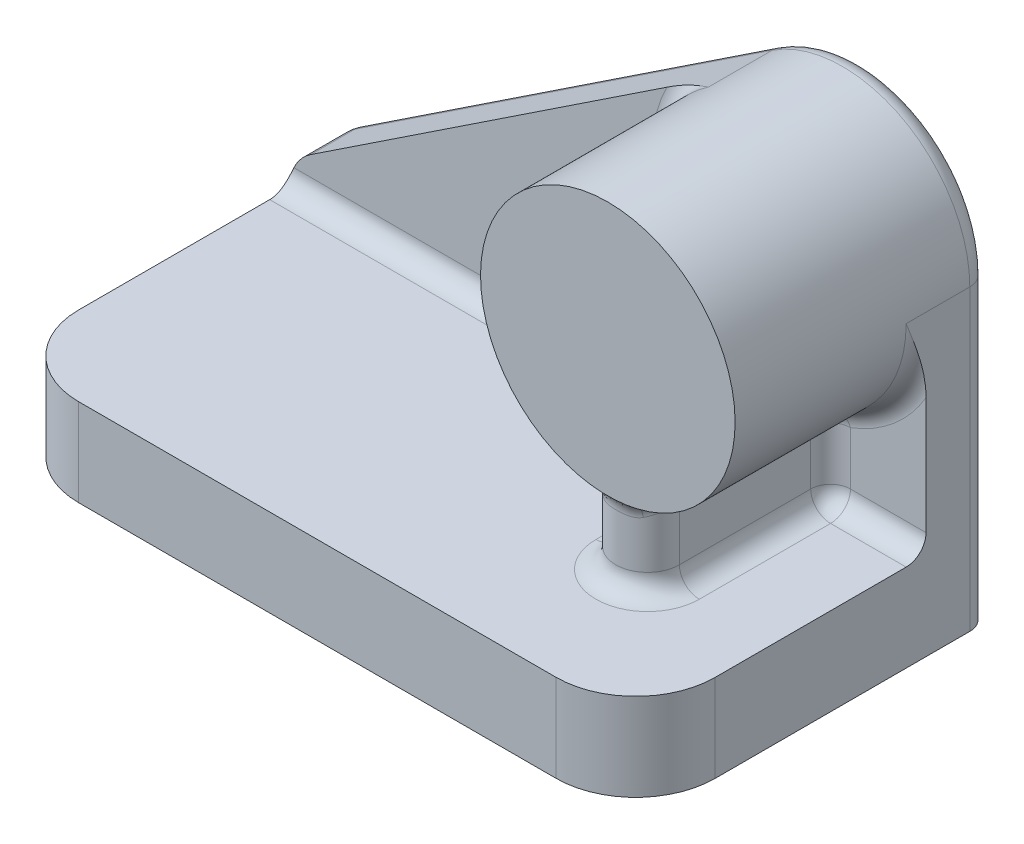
SolidWorks part; units mm, degrees
ref_plane "Front" through (0, 0, 0) normal (0, 0, 1) x (1, 0, 0)
ref_plane "Top" through (0, 0, 0) normal (0, 1, 0) x (1, 0, 0)
ref_plane "Right" through (0, 0, 0) normal (1, 0, 0) x (0, 0, -1)
sketch "Sketch1" plane through (0, 0, 0) normal (0, 1, 0) x (1, 0, 0)
  line L0 (0, 0) -> (160, 0)
  line L1 (0, 0) -> (0, 89)
  line L2 (0, 89) -> (160, 89)
  line L3 (160, 89) -> (160, 0)
  dimension "D1" = 89
  dimension "D4" = 160
extrude "Base_Plate" add sketch "Sketch1" along normal blind 22
fillet "Base_Fillet" radius 20 2 edges at (0, 11, 0) (160, 11, 0)
shell "Wall_Thickness" thickness 2
sketch "Sketch2" plane through (0, 0, -89) normal (0, 0, -1) x (-1, 0, 0)
  line L1 (-20, 0) -> (-140, 0) construction
  line L2 (-160, 22) -> (0, 22) construction
  line L3 (-160, 22) -> (0, 22)
  line L4 (-160, 22) -> (-160, 0) construction
  line L5 (-160, 22) -> (-160, 75)
  line L6 (-5.3632, 31.9976) -> (-110.3018, 101.6603)
  arc A0 (-110.3018, 101.6603) -> (-160, 75) centre (-128, 75) ccw
  arc A1 (0, 22) -> (-5.3632, 31.9976) centre (-12, 22) ccw
  dimension "D1" = 64
  dimension "D4" = 12
  dimension "D2" = 75
extrude "Vertical_Plate" add sketch "Sketch2" against normal blind 16
sketch "Sketch3" plane through (0, 0, -89) normal (0, 0, -1) x (-1, 0, 0)
  circle A0 centre (-128, 75) radius 32
  arc A1 (-110.3018, 101.6603) -> (-160, 75) centre (-128, 75) ccw construction
extrude "Circular_Boss" add sketch "Sketch3" against normal blind 64
sketch "Sketch4" plane through (0, 22, 0) normal (0, 1, 0) x (-1, 0, 0)
  line L0 (-96, -25) -> (-160, -25) construction
  line L1 (-96, -73) -> (-160, -73) construction
  line L2 (-120, -73) -> (-120, -35)
  line L3 (-128, -73) -> (-128, -89) construction
  line L5 (-136, -73) -> (-136, -35)
  line L7 (-136, -73) -> (-120, -73)
  arc A0 (-120, -35) -> (-136, -35) centre (-128, -35) ccw
  dimension "D2" = 8
  dimension "D1" = 2
extrude "Rib_Under" add sketch "Sketch4" along normal up to next
fillet "Rib_Fillet" radius 5 7 edges at (120, 44.0161, -54) (120, 22, -54) (127.1921, 43.0102, -27.0409) (128, 22, -27) (136, 22, -54) (136, 44.0161, -54)
fillet "Circ_Fillet" radius 5 18 edges at (1.4255, 27.6726, -89) (57.8325, 66.829, -89) (143.1271, 103.1988, -89) (154.3038, 56.7762, -73) (160, 37.5, -89) (0, 11, -89) (96.206, 71.3753, -73) (136, 33.6795, -73) (137.4645, 23.4645, -73) (136.89, 43.2065, -73) (120, 33.6795, -73) (118.5355, 23.4645, -73) (119.11, 43.2065, -73)
sketch "Contour Selection" plane through (3.6004, 22, -17.5327) normal (0, 1, 0) x (-1, 0, 0)
  line L0 (-76.3996, 17.5327) -> (-76.3996, -67.0852) construction
  line L1 (-16.3996, 17.5327) -> (-136.3996, 17.5327) construction
  line L2 (3.6004, -71.4673) -> (-156.3996, -71.4673) construction
  line L4 (-51.3996, 17.5327) -> (-101.3996, 17.5327)
  line L5 (-51.3996, 17.5327) -> (-51.3996, -36.4673)
  line L6 (-51.3996, -36.4673) -> (-101.3996, -36.4673)
  line L7 (-101.3996, 17.5327) -> (-101.3996, -36.4673)
  circle A0 centre (-76.3996, 0.5327) radius 7.5
  circle A1 centre (-76.3996, -24.4673) radius 7.5
  dimension "D3" = 15
  dimension "D4" = 25
  dimension "D5" = 12
  dimension "D1" = 35
  dimension "D2" = 50
